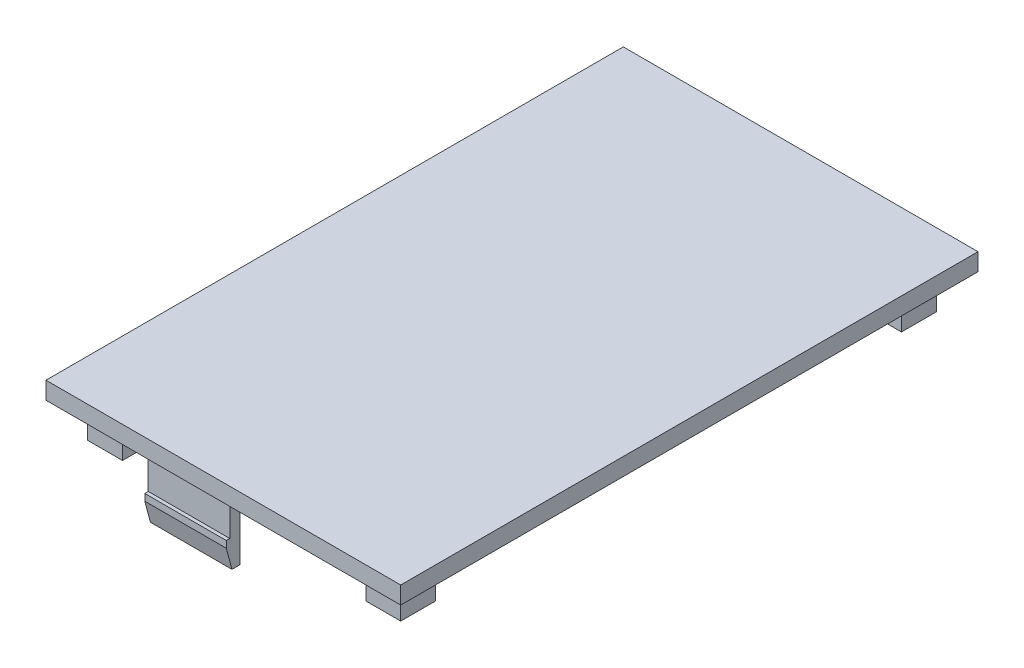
SolidWorks part; units mm, degrees
ref_plane "Front Plane" through (0, 0, 0) normal (0, 0, 1) x (1, 0, 0)
ref_plane "Top Plane" through (0, 0, 0) normal (0, 1, 0) x (1, 0, 0)
ref_plane "Right Plane" through (0, 0, 0) normal (1, 0, 0) x (0, 0, -1)
sketch "Sketch1" plane through (0, 0, 0) normal (0, 1, 0) x (1, 0, 0)
  line L1 (-221.5446, -0.1395) -> (-170.5446, -0.1395)
  line L2 (-221.5446, -0.1395) -> (-221.5446, -83.1395)
  line L3 (-221.5446, -83.1395) -> (-170.5446, -83.1395)
  line L4 (-170.5446, -0.1395) -> (-170.5446, -83.1395)
extrude "Boss-Extrude1" add sketch "Sketch1" along normal blind 2.5
sketch "Sketch2" plane through (-221.5446, 0, 0) normal (-1, 0, 0) x (0, 0, 1)
  line L0 (3.1395, 0) -> (3.1395, -7)
  line L1 (0.1395, 0) -> (83.1395, 0) construction
  line L2 (0.1395, 2.5) -> (0.1395, 0) construction
  line L3 (3.1395, -7) -> (2.6395, -7)
  line L4 (3.4524, -11) -> (4.6395, -11)
  line L5 (2.6395, -7) -> (2.6395, -7.9662)
  line L6 (2.6395, -7.9662) -> (3.4524, -11)
  line L7 (4.6395, -11) -> (4.6395, -4)
  line L8 (8.6395, 0) -> (3.1395, 0)
  line L9 (4.6395, -4) -> (8.6395, 0)
  dimension "D1" = 0.5
  dimension "D2" = 1.5
  dimension "D3" = 15
  dimension "D4" = 0.9662
  dimension "D5" = 7
  dimension "D6" = 3
  dimension "D7" = 4
  dimension "D8" = 45
  dimension "D9" = 4
extrude "Boss-Extrude2" add sketch "Sketch2" against normal up to surface (51 mm away)
ref_plane "Plane1" through (0, 0, 41.6395) normal (0, 0, -1) x (-1, 0, 0)
mirror "Mirror1" about plane through (0, 0, 41.6395) normal (0, 0, -1) of "Boss-Extrude2"
sketch "Sketch3" plane through (0, 0, 0) normal (0, -1, 0) x (1, 0, 0)
  line L0 (-221.5446, 83.1395) -> (-201.5446, 83.1395) construction
  line L1 (-221.5446, 83.1395) -> (-209.8456, 83.1395)
  line L2 (-221.5446, 83.1395) -> (-221.5446, 72.5375)
  line L3 (-221.5446, 72.5375) -> (-209.8456, 72.5375)
  line L4 (-209.8456, 83.1395) -> (-209.8456, 72.5375)
  line L5 (-198.1201, 83.1395) -> (-170.5446, 83.1395)
  line L6 (-198.1201, 83.1395) -> (-198.1201, 72.5375)
  line L7 (-198.1201, 72.5375) -> (-170.5446, 72.5375)
  line L8 (-170.5446, 83.1395) -> (-170.5446, 72.5375)
  line L9 (-170.5446, 83.1395) -> (-170.5446, 0.1395) construction
  line L10 (-221.5446, 0.1395) -> (-221.5446, 83.1395) construction
  line L11 (-136.0263, 41.6395) -> (-34.8566, 41.6395) construction
  line L14 (-221.5446, 83.1395) -> (-170.5446, 83.1395) construction
  line L15 (-170.5446, 0.1395) -> (-221.5446, 0.1395) construction
  line L16 (-170.5446, 0.1395) -> (-170.5446, 10.7415)
  line L17 (-198.1201, 10.7415) -> (-170.5446, 10.7415)
  line L18 (-198.1201, 0.1395) -> (-198.1201, 10.7415)
  line L19 (-198.1201, 0.1395) -> (-170.5446, 0.1395)
  line L20 (-209.8456, 0.1395) -> (-209.8456, 10.7415)
  line L21 (-221.5446, 10.7415) -> (-209.8456, 10.7415)
  line L22 (-221.5446, 0.1395) -> (-221.5446, 10.7415)
  line L23 (-221.5446, 0.1395) -> (-209.8456, 0.1395)
  dimension "D1" = 10.602
  dimension "D2" = 11.7255
  dimension "D3" = 11.6991
  dimension "D4" = 10.602
extrude "Cut-Extrude1" cut sketch "Sketch3" along normal through all
sketch "Sketch4" plane through (0, 0, 0) normal (0, -1, 0) x (1, 0, 0)
  line L0 (-213.5446, 80.1395) -> (-213.5446, 78.1395)
  line L1 (-213.5446, 78.1395) -> (-216.5446, 78.1395)
  line L2 (-216.5446, 78.1395) -> (-216.5446, 75.1395)
  line L3 (-216.5446, 75.1395) -> (-218.5446, 75.1395)
  line L4 (-218.5446, 75.1395) -> (-218.5446, 80.1395)
  line L5 (-218.5446, 80.1395) -> (-213.5446, 80.1395)
  line L6 (-221.5446, 0.1395) -> (-221.5446, 83.1395) construction
  line L7 (-221.5446, 83.1395) -> (-170.5446, 83.1395) construction
  line L8 (-166.6394, 41.6395) -> (-94.7547, 41.6395) construction
  line L9 (-196.0446, 71.9613) -> (-196.0446, -22.7858) construction
  line L10 (-170.5446, 83.1395) -> (-170.5446, 0.1395) construction
  line L11 (-170.5446, 0.1395) -> (-221.5446, 0.1395) construction
  line L12 (-173.5446, 80.1395) -> (-178.5446, 80.1395)
  line L13 (-173.5446, 75.1395) -> (-173.5446, 80.1395)
  line L14 (-175.5446, 75.1395) -> (-173.5446, 75.1395)
  line L15 (-175.5446, 78.1395) -> (-175.5446, 75.1395)
  line L16 (-178.5446, 78.1395) -> (-175.5446, 78.1395)
  line L17 (-178.5446, 80.1395) -> (-178.5446, 78.1395)
  line L18 (-178.5446, 3.1395) -> (-178.5446, 5.1395)
  line L19 (-178.5446, 5.1395) -> (-175.5446, 5.1395)
  line L20 (-175.5446, 5.1395) -> (-175.5446, 8.1395)
  line L21 (-175.5446, 8.1395) -> (-173.5446, 8.1395)
  line L22 (-173.5446, 8.1395) -> (-173.5446, 3.1395)
  line L23 (-173.5446, 3.1395) -> (-178.5446, 3.1395)
  line L24 (-218.5446, 3.1395) -> (-213.5446, 3.1395)
  line L25 (-218.5446, 8.1395) -> (-218.5446, 3.1395)
  line L26 (-216.5446, 8.1395) -> (-218.5446, 8.1395)
  line L27 (-216.5446, 5.1395) -> (-216.5446, 8.1395)
  line L28 (-213.5446, 5.1395) -> (-216.5446, 5.1395)
  line L29 (-213.5446, 3.1395) -> (-213.5446, 5.1395)
  dimension "D1" = 2
  dimension "D2" = 2
  dimension "D3" = 5
  dimension "D4" = 5
  dimension "D5" = 3
  dimension "D6" = 3
extrude "Boss-Extrude3" add sketch "Sketch4" along normal blind 5
